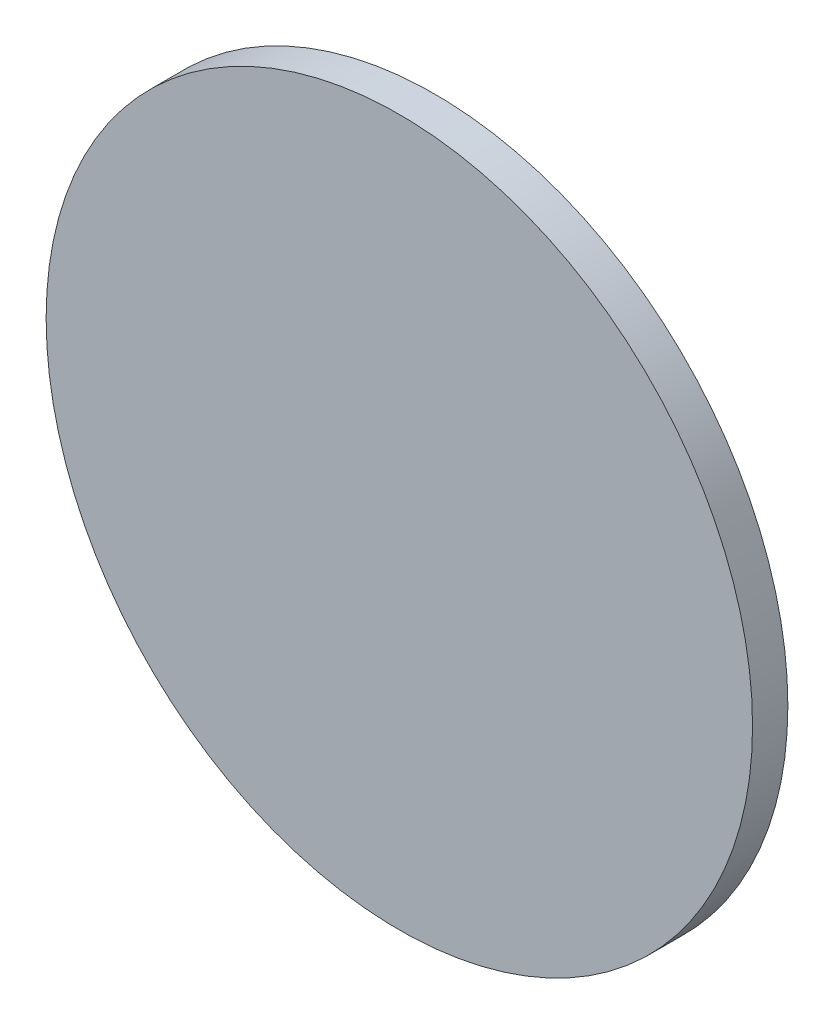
SolidWorks part; units mm, degrees
ref_plane "Front Plane" through (0, 0, 0) normal (0, 0, 1) x (1, 0, 0)
ref_plane "Top Plane" through (0, 0, 0) normal (0, 1, 0) x (1, 0, 0)
ref_plane "Right Plane" through (0, 0, 0) normal (1, 0, 0) x (0, 0, -1)
sketch "Sketch1" plane through (0, 0, 0) normal (0, 0, 1) x (1, 0, 0)
  circle A0 centre (0, 0) radius 5
extrude "Boss-Extrude1" add sketch "Sketch1" along normal up to surface (0.5 mm away)
